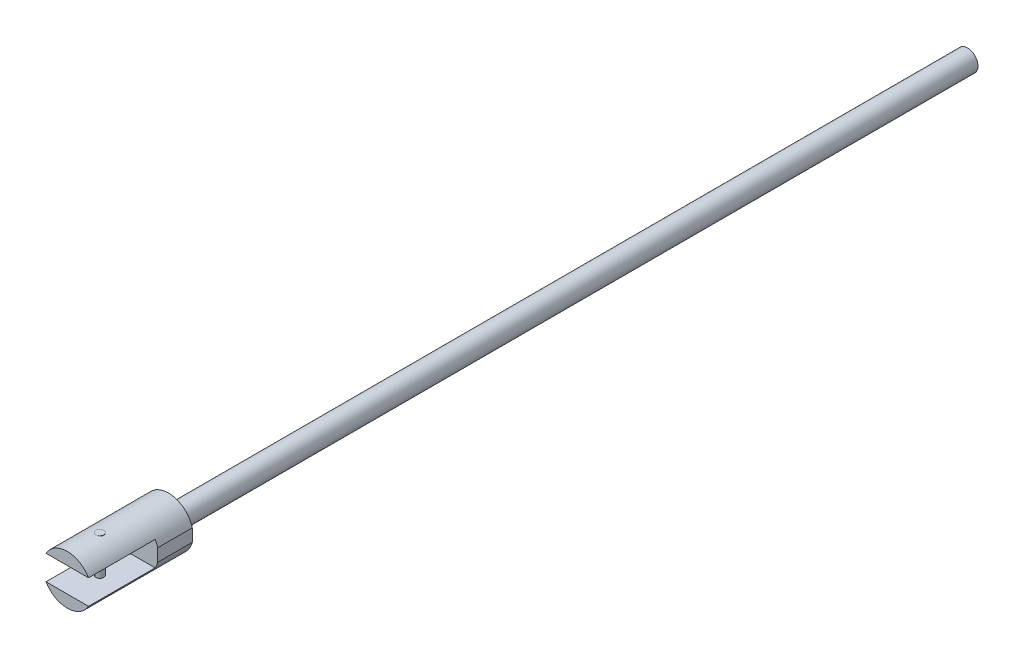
SolidWorks part; units mm, degrees
ref_plane "Front Plane" through (0, 0, 0) normal (0, 0, 1) x (1, 0, 0)
ref_plane "Top Plane" through (0, 0, 0) normal (0, 1, 0) x (1, 0, 0)
ref_plane "Right Plane" through (0, 0, 0) normal (1, 0, 0) x (0, 0, -1)
sketch "Sketch1" plane through (0, 0, 0) normal (0, 0, 1) x (1, 0, 0)
  circle A0 centre (0, 0) radius 2
extrude "Boss-Extrude1" add sketch "Sketch1" along normal blind 152.4
sketch "Sketch2" plane through (0, 0, 152.4) normal (0, 0, 1) x (1, 0, 0)
  line L1 (4.5342, -4.69) -> (-4.5342, -4.69)
  line L2 (4.5342, -4.69) -> (4.5342, 4.69)
  line L3 (4.5342, 4.69) -> (-4.5342, 4.69)
  line L4 (-4.5342, -4.69) -> (-4.5342, 4.69)
  line L5 (4.5342, -4.69) -> (-4.5342, 4.69) construction
  line L6 (4.5342, 4.69) -> (-4.5342, -4.69) construction
  point P0 (0, 0)
extrude "Boss-Extrude2" add sketch "Sketch2" along normal blind 6.604
sketch "Sketch3" plane through (0, 0, 159.004) normal (0, 0, 1) x (1, 0, 0)
  line L0 (4.5342, -4.69) -> (4.5342, 4.69) construction
  line L1 (-4.5342, 4.69) -> (4.5342, 4.69)
  line L2 (-4.5342, 4.69) -> (-4.5342, 2.3511)
  line L3 (-4.5342, 2.3511) -> (4.5342, 2.3511)
  line L4 (4.5342, 4.69) -> (4.5342, 2.3511)
  line L5 (-4.5342, 0) -> (4.5342, 0) construction
  line L6 (-4.5342, 4.69) -> (-4.5342, -4.69) construction
extrude "Boss-Extrude3" add sketch "Sketch3" along normal blind 12.7
mirror "Mirror1" about plane through (0, 0, 0) normal (0, 1, 0) of "Boss-Extrude3"
sketch "Sketch4" plane through (0, 4.69, 0) normal (0, 1, 0) x (1, 0, 0)
  circle A0 centre (0, -165.487) radius 0.75
  dimension "D1" = 1.5
sketch "Sketch5" plane through (0, 0, 171.704) normal (0, 0, 1) x (1, 0, 0)
  line L0 (4.5342, 4.69) -> (-4.5342, 4.69) construction
  circle A0 centre (0, 0) radius 4.69
extrude "Cut-Extrude2" cut sketch "Sketch5" against normal through all flip side to cut
extrude "Boss-Extrude4" add sketch "Sketch4" against normal up to surface (9.3799 mm away)
